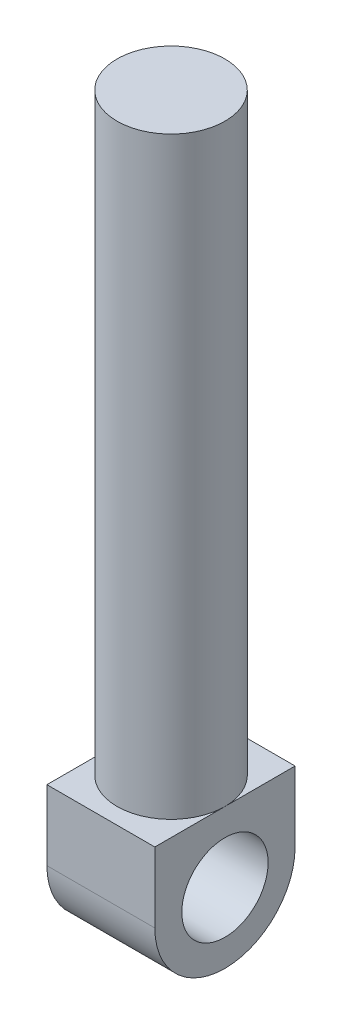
SolidWorks part; units mm, degrees
ref_plane "Front Plane" through (0, 0, 0) normal (0, 0, 1) x (1, 0, 0)
ref_plane "Top Plane" through (0, 0, 0) normal (0, 1, 0) x (1, 0, 0)
ref_plane "Right Plane" through (0, 0, 0) normal (1, 0, 0) x (0, 0, -1)
sketch "Sketch1" plane through (0, 0, 0) normal (1, 0, 0) x (0, 0, -1)
  line L0 (-65, 0) -> (-65, 65)
  line L1 (-65, 65) -> (65, 65)
  line L2 (65, 65) -> (65, 0)
  circle A0 centre (0, 0) radius 40
  circle A1 centre (0, 0) radius 65
  dimension "D1" = 80
  dimension "D2" = 130
extrude "Boss-Extrude1" add sketch "Sketch1" along normal mid plane 100 contours A1 L2 L1 L0 | A1 A0 | A1 L1 L0
sketch "Sketch2" plane through (0, 65, 130) normal (0, 1, 0) x (1, 0, 0)
  line L0 (0, 65) -> (0, 130) construction
  line L1 (50, 65) -> (-50, 65) construction
  circle A0 centre (0, 130) radius 70
  circle A1 centre (0, 130) radius 50
  point P3 (0, 130)
  dimension "D1" = 140
  dimension "D2" = 100
extrude "Boss-Extrude3" add sketch "Sketch2" along normal blind 550 separate body
